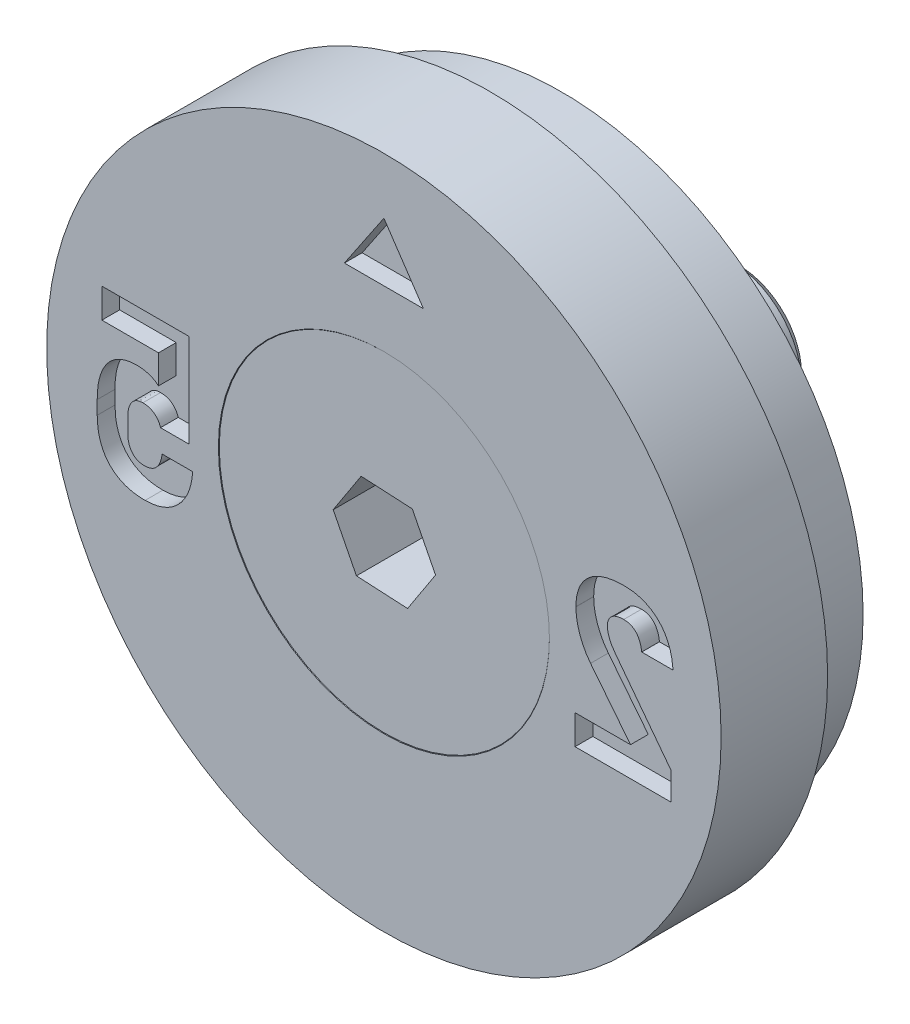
SolidWorks part; units mm, degrees
other "<M4 X .7 FHCS>-<Imported1>"
ref_plane "Front Plane" through (0, 0, 0) normal (0, 0, 1) x (1, 0, 0)
ref_plane "Top Plane" through (0, 0, 0) normal (0, 1, 0) x (1, 0, 0)
ref_plane "Right Plane" through (0, 0, 0) normal (1, 0, 0) x (0, 0, -1)
imported_body "Imported1"
sketch "Sketch1" plane through (0, 0, 0) normal (0, 0, 1) x (1, 0, 0)
  text T0 "2       5" font "Bahnschrift" height 4.572
  dimension "D1" = 2.286
extrude "Cut-Extrude1" cut sketch "Sketch1" against normal blind 0.5
inserted part "M4 X .7 FHCS"
move or copy body "Body-Move/Copy2" placed by mates yes
